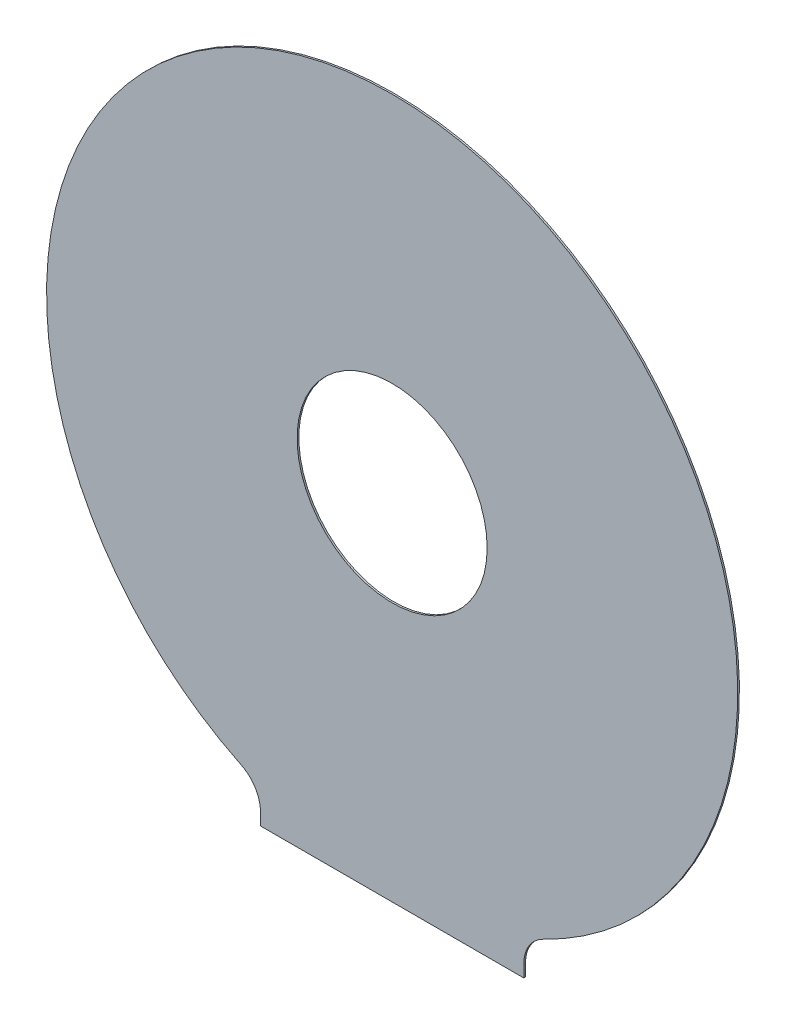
SolidWorks part; units mm, degrees
ref_plane "Front Plane" through (0, 0, 0) normal (0, 0, 1) x (1, 0, 0)
ref_plane "Top Plane" through (0, 0, 0) normal (0, 1, 0) x (1, 0, 0)
ref_plane "Right Plane" through (0, 0, 0) normal (1, 0, 0) x (0, 0, -1)
sketch "Sketch1" plane through (0, 0, 0) normal (0, 0, 1) x (1, 0, 0)
  line L677 (3.81, -10.2458) -> (3.81, -9.8926)
  line L678 (-3.81, -9.8926) -> (-3.81, -10.2458)
  line L679 (-3.81, -10.2458) -> (3.81, -10.2458)
  circle A266 centre (0, 0) radius 2.75
  arc A267 (4.3727, -8.9933) -> (3.81, -9.8926) centre (4.81, -9.8926) ccw
  arc A268 (4.3727, -8.9933) -> (-4.3727, -8.9933) centre (0, 0) ccw
  arc A269 (-3.81, -9.8926) -> (-4.3727, -8.9933) centre (-4.81, -9.8926) ccw
extrude "Boss-Extrude1" add sketch "Sketch1" along normal blind 0.05
